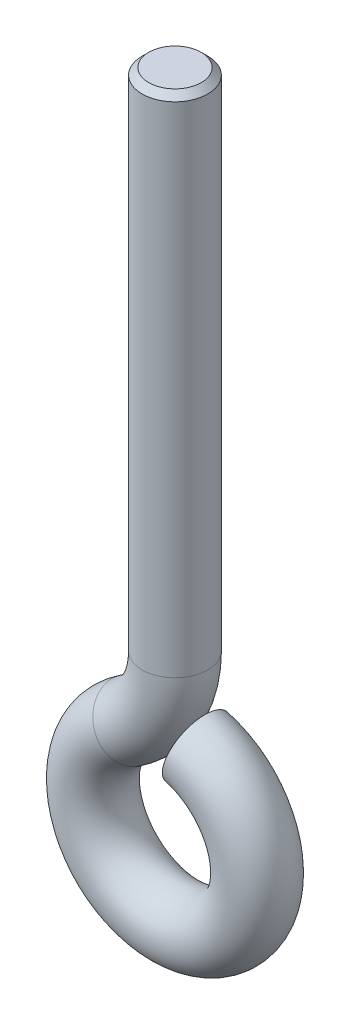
SolidWorks part; units mm, degrees
ref_plane "Plan de face" through (0, 0, 0) normal (0, 0, 1) x (1, 0, 0)
ref_plane "Plan de dessus" through (0, 0, 0) normal (0, 1, 0) x (1, 0, 0)
ref_plane "Plan de droite" through (0, 0, 0) normal (1, 0, 0) x (0, 0, -1)
sketch "Esquisse1" plane through (0, 0, 0) normal (0, 0, 1) x (1, 0, 0)
  line L0 (0, 46.0977) -> (0, 200)
  line L1 (0, 0) -> (6.4705, 24.1481) construction
  arc A0 (-13.6364, 20.9535) -> (6.4705, 24.1481) centre (0, 0) ccw
  arc A1 (0, 46.0977) -> (-13.6364, 20.9535) centre (-30, 46.0977) cw
  point P7 (0, 25)
  dimension "D2" = 50
  dimension "D4" = 30
  dimension "D1" = 200
  dimension "D3" = 15
ref_plane "Plan1" through (0, 200, 0) normal (0, 1, 0) x (-1, 0, 0)
sketch "Esquisse2" plane through (0, 200, 0) normal (0, 1, 0) x (-1, 0, 0)
  circle A0 centre (0, 0) radius 10
  dimension "D1" = 20
sweep "Balayage1" add profiles "Esquisse2" path "Esquisse1"
chamfer "Chanfrein1" distance 2 angle 45 1 edges at (0, 200, 10)
